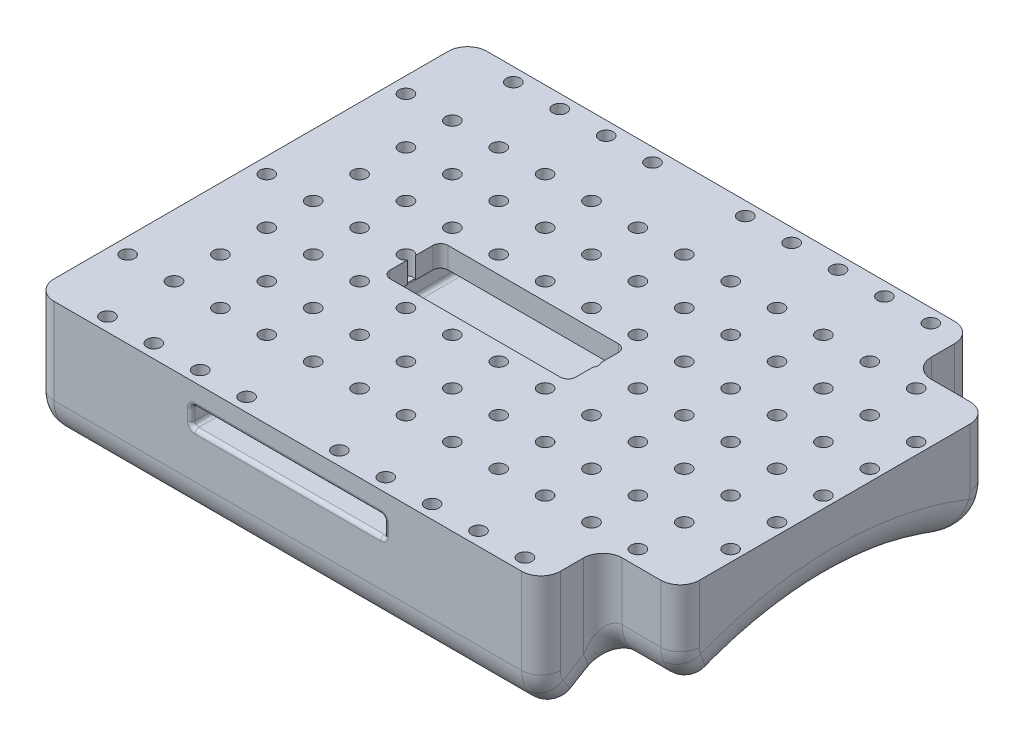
SolidWorks part; units mm, degrees
ref_plane "Front Plane" through (0, 0, 0) normal (0, 0, 1) x (1, 0, 0)
ref_plane "Top Plane" through (0, 0, 0) normal (0, 1, 0) x (1, 0, 0)
ref_plane "Right Plane" through (0, 0, 0) normal (1, 0, 0) x (0, 0, -1)
sketch "Sketch1" plane through (0, 0, 0) normal (0, 1, 0) x (1, 0, 0)
  line L1 (-100, 56) -> (100, 56)
  line L2 (-100, 56) -> (-100, -56)
  line L3 (-100, -56) -> (100, -56)
  line L4 (100, 56) -> (100, -56)
  line L5 (-100, 56) -> (100, -56) construction
  line L6 (-100, -56) -> (100, 56) construction
  point P0 (0, 0)
  dimension "D1" = 200
  dimension "D2" = 112
extrude "Boss-Extrude1" add sketch "Sketch1" along normal blind 6
sketch "Sketch3" plane through (0, 0, 0) normal (0, 1, 0) x (1, 0, 0)
  line L0 (-100, 0) -> (-110, 0)
  line L1 (-100, 56) -> (-100, -56) construction
  line L2 (-110, 25) -> (-110, -25)
  line L3 (-110, 25) -> (-100, 56)
  line L4 (-110, -25) -> (-100, -56)
  line L5 (-100, -56) -> (-100, 56)
  point P8 (-110, 0)
  dimension "D1" = 50
extrude "Boss-Extrude2" add sketch "Sketch3" along normal blind 6 contours L0 L5 L3 L2 | L4 L5 L0 L2
fillet "Fillet1" radius 10 4 edges at (-100, 3, 56) (-110, 3, 25) (-110, 3, -25) (-100, 3, -56)
sketch "Sketch5" plane through (0, 0, 0) normal (0, 1, 0) x (1, 0, 0)
  line L1 (100, 56) -> (157.9995, 56)
  line L2 (100, 56) -> (100, -56)
  line L3 (100, -56) -> (157.9995, -56)
  line L4 (157.9995, 56) -> (157.9995, -56)
  dimension "D1" = 112
extrude "Boss-Extrude3" add sketch "Sketch5" along normal blind 6
sketch "Sketch8" plane through (0, 6, 0) normal (0, 1, 0) x (1, 0, 0)
  line L0 (106.9378, 56) -> (106.9378, -56)
  line L1 (157.9995, 56) -> (-92.7184, 56) construction
  line L2 (-92.7184, -56) -> (157.9995, -56) construction
  line L3 (106.9378, 0) -> (156.9378, 0)
  line L4 (106.9378, -56) -> (131.9378, -56)
  line L5 (131.9378, -56) -> (156.9378, -50)
  line L6 (131.9378, 56) -> (156.9378, 50)
  line L7 (106.9378, 56) -> (131.9378, 56)
  circle A0 centre (156.9378, 0) radius 50
  dimension "D1" = 25
extrude "Boss-Extrude4" add sketch "Sketch8" against normal blind 6 contours A0 M16
fillet "Fillet2" radius 20 2 edges at (157.9995, 3, 56) (157.9995, 3, -56)
fillet "Fillet3" radius 20 2 edges at (157.9995, 3, 49.9887) (157.9995, 3, -49.9887)
sketch "Sketch10" plane through (0, 6, 0) normal (0, 1, 0) x (1, 0, 0)
  line L0 (110.9378, 0) -> (202.9378, 0)
  line L1 (114.4408, 17.6069) -> (114.4379, -17.6)
  line L2 (-92.7184, -56) -> (143.7056, -56) construction
  circle A0 centre (156.9378, 0) radius 46
  circle A3 centre (114.4408, 17.6069) radius 1.65
  circle A4 centre (139.3378, 42.4999) radius 1.65
  circle A5 centre (174.5447, 42.497) radius 1.65
  circle A6 centre (199.4377, 17.6) radius 1.65
  circle A7 centre (199.4349, -17.6069) radius 1.65
  circle A8 centre (174.5378, -42.4999) radius 1.65
  circle A9 centre (139.331, -42.497) radius 1.65
  circle A10 centre (114.4379, -17.6) radius 1.65
  dimension "D1" = 8
  dimension "D5" = 3.3
  dimension "D3" = 92
  dimension "D4" = 17.6
  dimension "D2" = 35.2069
  dimension "D6" = 56
extrude "Cut-Extrude4" cut sketch "Sketch10" against normal blind 3 contours A10 | A3 | A4 | A5 | A9 | A8 | A7 | A6
sketch "Sketch11" plane through (0, 6, 0) normal (0, 1, 0) x (1, 0, 0)
  line L2 (139.331, -42.497) -> (139.289, -42.7462)
  line L4 (174.5378, -42.4999) -> (199.4349, -17.6069)
  line L8 (139.3378, 42.4999) -> (114.4408, 17.6069)
  line L9 (156.9378, 50) -> (106.9378, 50)
  line L10 (106.9378, 50) -> (106.9378, 0)
  line L11 (106.9378, 0) -> (106.9378, -50)
  line L12 (106.9378, -50) -> (156.9378, -50)
  line L13 (106.9378, 50) -> (113.4008, 43.537)
  line L14 (106.9378, 0) -> (113.4008, 0)
  circle A1 centre (113.4008, 43.537) radius 1.65
  circle A2 centre (113.4008, -43.537) radius 1.65
extrude "Cut-Extrude5" cut sketch "Sketch11" against normal blind 7.5
sketch "Sketch13" plane through (0, 6, 0) normal (0, 1, 0) x (1, 0, 0)
  line L0 (-106.5, 0) -> (-84.1762, 0)
  line L10 (-92.7184, -52.5) -> (143.7056, -52.5)
  line L11 (143.7056, 52.5) -> (-92.7184, 52.5)
  line L12 (-98.9045, 47.9955) -> (-106.1861, 25.4225)
  line L13 (-106.5, 23.427) -> (-106.5, -23.427)
  line L14 (-106.1861, -25.4225) -> (-98.9045, -47.9955)
  line L15 (-92.7184, -52.5) -> (143.7056, -52.5)
  line L16 (143.7056, 52.5) -> (-92.7184, 52.5)
  line L17 (-98.9045, 47.9955) -> (-106.1861, 25.4225)
  line L18 (-106.5, 23.427) -> (-106.5, -23.427)
  line L19 (-106.1861, -25.4225) -> (-98.9045, -47.9955)
  circle A0 centre (-92.7184, -52.5) radius 1.8
  circle A1 centre (-80.7184, -52.5) radius 1.8
  circle A2 centre (-80.7184, 52.5) radius 1.8
  circle A3 centre (-68.7184, -52.5) radius 1.8
  circle A4 centre (-68.7184, 52.5) radius 1.8
  circle A5 centre (-56.7184, -52.5) radius 1.8
  circle A6 centre (-56.7184, 52.5) radius 1.8
  circle A7 centre (-44.7184, -52.5) radius 1.8
  circle A8 centre (-44.7184, 52.5) radius 1.8
  circle A9 centre (-92.7184, 52.5) radius 1.8
  circle A10 centre (-32.7184, -52.5) radius 1.8
  circle A11 centre (-32.7184, 52.5) radius 1.8
  circle A12 centre (-20.7184, -52.5) radius 1.8
  circle A13 centre (-20.7184, 52.5) radius 1.8
  circle A14 centre (-8.7184, -52.5) radius 1.8
  circle A15 centre (-8.7184, 52.5) radius 1.8
  circle A16 centre (3.2816, -52.5) radius 1.8
  circle A17 centre (3.2816, 52.5) radius 1.8
  arc A18 (143.7056, -52.5) -> (152.7479, -49.8017) centre (143.7056, -36) ccw
  arc A19 (162.7095, -46.1404) -> (152.7479, -49.8017) centre (165.6263, -69.4587) ccw
  arc A20 (162.7095, -46.1404) -> (162.7095, 46.1404) centre (156.9378, 0) ccw
  arc A21 (152.7479, 49.8017) -> (162.7095, 46.1404) centre (165.6263, 69.4587) ccw
  arc A22 (152.7479, 49.8017) -> (143.7056, 52.5) centre (143.7056, 36) ccw
  arc A23 (-92.7184, 52.5) -> (-98.9045, 47.9955) centre (-92.7184, 46) ccw
  arc A24 (-106.1861, 25.4225) -> (-106.5, 23.427) centre (-100, 23.427) ccw
  arc A25 (-106.5, -23.427) -> (-106.1861, -25.4225) centre (-100, -23.427) ccw
  arc A26 (-98.9045, -47.9955) -> (-92.7184, -52.5) centre (-92.7184, -46) ccw
  arc A27 (143.7056, -52.5) -> (152.7479, -49.8017) centre (143.7056, -36) ccw
  arc A28 (162.7095, -46.1404) -> (152.7479, -49.8017) centre (165.6263, -69.4587) ccw
  arc A29 (162.7095, -46.1404) -> (162.7095, 46.1404) centre (156.9378, 0) ccw
  arc A30 (152.7479, 49.8017) -> (162.7095, 46.1404) centre (165.6263, 69.4587) ccw
  arc A31 (152.7479, 49.8017) -> (143.7056, 52.5) centre (143.7056, 36) ccw
  arc A32 (-92.7184, 52.5) -> (-98.9045, 47.9955) centre (-92.7184, 46) ccw
  arc A33 (-106.1861, 25.4225) -> (-106.5, 23.427) centre (-100, 23.427) ccw
  arc A34 (-106.5, -23.427) -> (-106.1861, -25.4225) centre (-100, -23.427) ccw
  arc A35 (-98.9045, -47.9955) -> (-92.7184, -52.5) centre (-92.7184, -46) ccw
  circle A36 centre (15.2816, -52.5) radius 1.8
  circle A37 centre (15.2816, 52.5) radius 1.8
  circle A38 centre (27.2816, -52.5) radius 1.8
  circle A39 centre (27.2816, 52.5) radius 1.8
  circle A40 centre (39.2816, -52.5) radius 1.8
  circle A41 centre (39.2816, 52.5) radius 1.8
  circle A42 centre (51.2816, -52.5) radius 1.8
  circle A43 centre (51.2816, 52.5) radius 1.8
  circle A44 centre (63.2816, -52.5) radius 1.8
  circle A45 centre (63.2816, 52.5) radius 1.8
  circle A46 centre (75.2816, -52.5) radius 1.8
  circle A47 centre (75.2816, 52.5) radius 1.8
  circle A48 centre (87.2816, -52.5) radius 1.8
  circle A49 centre (87.2816, 52.5) radius 1.8
  circle A50 centre (99.2816, -52.5) radius 1.8
  circle A51 centre (99.2816, 52.5) radius 1.8
  circle A52 centre (111.2816, -52.5) radius 1.8
  circle A53 centre (111.2816, 52.5) radius 1.8
  circle A54 centre (123.2816, -52.5) radius 1.8
  circle A55 centre (123.2816, 52.5) radius 1.8
  circle A56 centre (135.2816, -52.5) radius 1.8
  circle A57 centre (135.2816, 52.5) radius 1.8
  dimension "D2" = 20
  dimension "D1" = 3.5
extrude "Cut-Extrude7" cut sketch "Sketch13" against normal blind 10 contours A9 | A2 | A4 | A6 | A11 | A13 | A15 | A17 | A39 | A41 | A43 | A45 | A47 | A49 | A51 | A53 | A55 | A57 | A56 | A54 | A52 | A50 | A48 | A46 | A40 | A38 | A16 | A14 | A12 | A10 | A5 | A0 | A1 | A3 | A44 | A42
sketch "Sketch14" plane through (0, 6, 0) normal (0, 1, 0) x (1, 0, 0)
  line L0 (-110, 0) -> (-70, 0)
  line L1 (-110, 23.427) -> (-110, -23.427) construction
  line L2 (-70, 0) -> (30, 0)
  circle A0 centre (-20, 0) radius 1.8
  circle A1 centre (-8, 0) radius 1.8
  circle A2 centre (4, 0) radius 1.8
  circle A3 centre (16, 0) radius 1.8
  circle A4 centre (28, 0) radius 1.8
  circle A5 centre (-32, 0) radius 1.8
  circle A6 centre (-44, 0) radius 1.8
  circle A7 centre (-56, 0) radius 1.8
  circle A8 centre (-68, 0) radius 1.8
  circle A9 centre (-68, 12) radius 1.8
  circle A17 centre (28, 12) radius 1.8
  circle A18 centre (-68, 24) radius 1.8
  circle A26 centre (28, 24) radius 1.8
  circle A27 centre (-68, 36) radius 1.8
  circle A28 centre (-56, 36) radius 1.8
  circle A29 centre (-44, 36) radius 1.8
  circle A30 centre (-32, 36) radius 1.8
  circle A31 centre (-20, 36) radius 1.8
  circle A32 centre (-8, 36) radius 1.8
  circle A33 centre (4, 36) radius 1.8
  circle A34 centre (16, 36) radius 1.8
  circle A35 centre (28, 36) radius 1.8
  circle A36 centre (-68, -12) radius 1.8
  circle A44 centre (28, -12) radius 1.8
  circle A45 centre (-68, -24) radius 1.8
  circle A53 centre (28, -24) radius 1.8
  circle A54 centre (-68, -36) radius 1.8
  circle A55 centre (-56, -36) radius 1.8
  circle A56 centre (-44, -36) radius 1.8
  circle A57 centre (-32, -36) radius 1.8
  circle A58 centre (-20, -36) radius 1.8
  circle A59 centre (-8, -36) radius 1.8
  circle A60 centre (4, -36) radius 1.8
  circle A61 centre (16, -36) radius 1.8
  circle A62 centre (28, -36) radius 1.8
  circle A63 centre (40, 36) radius 1.8
  circle A64 centre (40, 24) radius 1.8
  circle A65 centre (40, 12) radius 1.8
  circle A66 centre (40, 0) radius 1.8
  circle A69 centre (40, -36) radius 1.8
  circle A70 centre (52, 36) radius 1.8
  circle A73 centre (52, 0) radius 1.8
  circle A76 centre (52, -36) radius 1.8
  circle A77 centre (64, 36) radius 1.8
  circle A80 centre (64, 0) radius 1.8
  circle A83 centre (64, -36) radius 1.8
  circle A84 centre (76, 36) radius 1.8
  circle A87 centre (76, 0) radius 1.8
  circle A90 centre (76, -36) radius 1.8
  circle A91 centre (88, 36) radius 1.8
  circle A94 centre (88, 0) radius 1.8
  circle A97 centre (88, -36) radius 1.8
  circle A98 centre (100, 36) radius 1.8
  circle A101 centre (100, 0) radius 1.8
  circle A104 centre (100, -36) radius 1.8
  circle A105 centre (112, 36) radius 1.8
  circle A106 centre (112, 24) radius 1.8
  circle A107 centre (112, 12) radius 1.8
  circle A108 centre (112, 0) radius 1.8
  circle A109 centre (112, -12) radius 1.8
  circle A110 centre (112, -24) radius 1.8
  circle A111 centre (112, -36) radius 1.8
  circle A112 centre (-56, -12) radius 1.8
  circle A113 centre (-44, -12) radius 1.8
  circle A114 centre (-32, -12) radius 1.8
  circle A115 centre (-20, -12) radius 1.8
  circle A116 centre (-8, -12) radius 1.8
  circle A117 centre (4, -12) radius 1.8
  circle A118 centre (16, -12) radius 1.8
  circle A119 centre (-56, -24) radius 1.8
  circle A120 centre (-44, -24) radius 1.8
  circle A121 centre (-32, -24) radius 1.8
  circle A122 centre (-20, -24) radius 1.8
  circle A123 centre (-8, -24) radius 1.8
  circle A124 centre (4, -24) radius 1.8
  circle A125 centre (16, -24) radius 1.8
  circle A126 centre (-56, 12) radius 1.8
  circle A127 centre (-44, 12) radius 1.8
  circle A128 centre (-32, 12) radius 1.8
  circle A129 centre (-20, 12) radius 1.8
  circle A130 centre (-8, 12) radius 1.8
  circle A131 centre (4, 12) radius 1.8
  circle A132 centre (16, 12) radius 1.8
  circle A133 centre (-56, 24) radius 1.8
  circle A134 centre (-44, 24) radius 1.8
  circle A135 centre (-32, 24) radius 1.8
  circle A136 centre (-20, 24) radius 1.8
  circle A137 centre (-8, 24) radius 1.8
  circle A138 centre (4, 24) radius 1.8
  circle A139 centre (16, 24) radius 1.8
  circle A140 centre (52, 24) radius 1.8
  circle A141 centre (52, 12) radius 1.8
  circle A142 centre (64, 24) radius 1.8
  circle A143 centre (64, 12) radius 1.8
  circle A144 centre (76, 24) radius 1.8
  circle A145 centre (76, 12) radius 1.8
  circle A146 centre (88, 24) radius 1.8
  circle A147 centre (88, 12) radius 1.8
  circle A148 centre (100, 24) radius 1.8
  circle A149 centre (100, 12) radius 1.8
  circle A150 centre (40, -12) radius 1.8
  circle A151 centre (40, -24) radius 1.8
  circle A152 centre (52, -12) radius 1.8
  circle A153 centre (52, -24) radius 1.8
  circle A154 centre (64, -12) radius 1.8
  circle A155 centre (64, -24) radius 1.8
  circle A156 centre (76, -12) radius 1.8
  circle A157 centre (76, -24) radius 1.8
  circle A158 centre (88, -12) radius 1.8
  circle A159 centre (88, -24) radius 1.8
  circle A160 centre (100, -12) radius 1.8
  circle A161 centre (100, -24) radius 1.8
  circle A162 centre (40, -12) radius 1.8
  circle A163 centre (40, -24) radius 1.8
  dimension "D1" = 5
  dimension "D2" = 5
  dimension "D3" = 4
  dimension "D4" = 4
  dimension "D5" = 8
  dimension "D6" = 3
extrude "Cut-Extrude12" cut sketch "Sketch14" against normal blind 10 contours L2 A0 | L2 A0 | A73 | A80 | A63 | A70 | A27 | A18 | A28 | A29 | A30 | A31 | A32 | A33 | A34 | A9 | A8 | A7 | A36 | A45 | A54 | A55 | A56 | A57 | A58 | A59 | A60 | A61 | A62 | A53 | A44 | A4 | A3 | A2 | A1 | A5 | A6 | A17 | A26 | A64 | A65 | A66 | A162 | A35 | A77 | A83 | A76 | A69 | A163 | A87 | A94 | A101 | A108 | A109 | A110 | A107
sketch "Sketch15" plane through (0, 6, 0) normal (0, 1, 0) x (1, 0, 0)
  line L0 (206.9378, 0) -> (-48.0622, 0)
  line L2 (-48.0622, 65.6555) -> (-123.834, 65.6555)
  line L3 (-48.0622, 65.6555) -> (-48.0622, -63.0721)
  line L4 (-48.0622, -63.0721) -> (-123.834, -63.0721)
  line L5 (-123.834, 65.6555) -> (-123.834, -63.0721)
  arc A0 (163.1439, -49.6134) -> (163.1439, 49.6134) centre (156.9378, 0) ccw construction
  dimension "D1" = 255
extrude "Cut-Extrude13" cut sketch "Sketch15" against normal blind 10 contours L2 L5 L4 L3
sketch "Sketch16" plane through (0, 6, 0) normal (0, 1, 0) x (1, 0, 0)
  line L0 (-48.0622, 0) -> (102.9378, 0)
  line L1 (-48.0622, 56) -> (-48.0622, -56) construction
  line L3 (102.9378, 64.6969) -> (216.5279, 64.6969)
  line L4 (102.9378, 64.6969) -> (102.9378, -67.3494)
  line L5 (102.9378, -67.3494) -> (216.5279, -67.3494)
  line L6 (216.5279, 64.6969) -> (216.5279, -67.3494)
extrude "Cut-Extrude14" cut sketch "Sketch16" against normal blind 10 contours L6 L3 L4 L5
sketch "Sketch17" plane through (0, 6, 0) normal (0, 1, 0) x (1, 0, 0)
  line L0 (102.9378, 0) -> (82.9378, 0)
  line L1 (102.9378, 56) -> (102.9378, -56) construction
  line L3 (82.9378, 40) -> (102.9378, 40)
  line L4 (82.9378, 40) -> (82.9378, -40)
  line L5 (82.9378, -40) -> (102.9378, -40)
  line L6 (102.9378, 40) -> (102.9378, -40)
  line L7 (82.9378, 40) -> (102.9378, -40) construction
  line L8 (82.9378, -40) -> (102.9378, 40) construction
  line L9 (82.9378, 40) -> (116.8738, 40)
  line L10 (82.9378, 40) -> (82.9378, 66.2952)
  line L11 (82.9378, 66.2952) -> (116.8738, 66.2952)
  line L12 (116.8738, 40) -> (116.8738, 66.2952)
  line L13 (82.9378, -40) -> (120.0009, -40)
  line L14 (82.9378, -40) -> (82.9378, -61.9172)
  line L15 (82.9378, -61.9172) -> (120.0009, -61.9172)
  line L16 (120.0009, -40) -> (120.0009, -61.9172)
  point P5 (92.9378, 0)
  dimension "D1" = 20
  dimension "D2" = 80
extrude "Cut-Extrude15" cut sketch "Sketch17" against normal blind 10 contours L9 L12 L11 L10 L3 | L16 L13 L5 L14 L15
fillet "Fillet4" radius 5 4 edges at (82.9378, 3, 40) (82.9378, 3, -40) (102.9378, 3, 40) (102.9378, 3, -40)
fillet "Fillet5" radius 5 4 edges at (82.9378, 3, -56) (-48.0622, 3, -56) (-48.0622, 3, 56) (82.9378, 3, 56)
sketch "Sketch18" plane through (0, 6, 0) normal (0, 1, 0) x (1, 0, 0)
  circle A0 centre (-32, 36) radius 1.8
  circle A1 centre (-20, 36) radius 1.8
  circle A2 centre (-8, 36) radius 1.8
  circle A3 centre (4, 36) radius 1.8
  circle A4 centre (16, 36) radius 1.8
  circle A5 centre (28, 36) radius 1.8
  circle A6 centre (40, 36) radius 1.8
  circle A7 centre (52, 36) radius 1.8
  circle A8 centre (64, 36) radius 1.8
  circle A9 centre (76, 36) radius 1.8
  circle A10 centre (88, 36) radius 1.8
  circle A12 centre (-20, 24) radius 1.8
  circle A13 centre (-8, 24) radius 1.8
  circle A14 centre (4, 24) radius 1.8
  circle A15 centre (16, 24) radius 1.8
  circle A16 centre (28, 24) radius 1.8
  circle A17 centre (40, 24) radius 1.8
  circle A18 centre (52, 24) radius 1.8
  circle A19 centre (64, 24) radius 1.8
  circle A20 centre (76, 24) radius 1.8
  circle A21 centre (88, 24) radius 1.8
  circle A22 centre (100, 24) radius 1.8
  circle A23 centre (-20, 12) radius 1.8
  circle A24 centre (-8, 12) radius 1.8
  circle A25 centre (4, 12) radius 1.8
  circle A26 centre (16, 12) radius 1.8
  circle A27 centre (28, 12) radius 1.8
  circle A28 centre (40, 12) radius 1.8
  circle A29 centre (52, 12) radius 1.8
  circle A30 centre (64, 12) radius 1.8
  circle A31 centre (76, 12) radius 1.8
  circle A32 centre (88, 12) radius 1.8
  circle A33 centre (100, 12) radius 1.8
  circle A34 centre (-20, 0) radius 1.8
  circle A35 centre (-8, 0) radius 1.8
  circle A36 centre (4, 0) radius 1.8
  circle A37 centre (16, 0) radius 1.8
  circle A38 centre (28, 0) radius 1.8
  circle A39 centre (40, 0) radius 1.8
  circle A40 centre (52, 0) radius 1.8
  circle A41 centre (64, 0) radius 1.8
  circle A42 centre (76, 0) radius 1.8
  circle A43 centre (88, 0) radius 1.8
  circle A44 centre (100, 0) radius 1.8
  circle A45 centre (-20, -12) radius 1.8
  circle A46 centre (-8, -12) radius 1.8
  circle A47 centre (4, -12) radius 1.8
  circle A48 centre (16, -12) radius 1.8
  circle A49 centre (28, -12) radius 1.8
  circle A50 centre (40, -12) radius 1.8
  circle A51 centre (52, -12) radius 1.8
  circle A52 centre (64, -12) radius 1.8
  circle A53 centre (76, -12) radius 1.8
  circle A54 centre (88, -12) radius 1.8
  circle A55 centre (100, -12) radius 1.8
  circle A56 centre (-20, -24) radius 1.8
  circle A57 centre (-8, -24) radius 1.8
  circle A58 centre (4, -24) radius 1.8
  circle A59 centre (16, -24) radius 1.8
  circle A60 centre (28, -24) radius 1.8
  circle A61 centre (40, -24) radius 1.8
  circle A62 centre (52, -24) radius 1.8
  circle A63 centre (64, -24) radius 1.8
  circle A64 centre (76, -24) radius 1.8
  circle A65 centre (88, -24) radius 1.8
  circle A66 centre (100, -24) radius 1.8
  circle A67 centre (-20, -36) radius 1.8
  circle A68 centre (-8, -36) radius 1.8
  circle A69 centre (4, -36) radius 1.8
  circle A70 centre (16, -36) radius 1.8
  circle A71 centre (28, -36) radius 1.8
  circle A72 centre (40, -36) radius 1.8
  circle A73 centre (52, -36) radius 1.8
  circle A74 centre (64, -36) radius 1.8
  circle A75 centre (76, -36) radius 1.8
  circle A76 centre (88, -36) radius 1.8
  circle A78 centre (-32, 24) radius 1.8
  circle A79 centre (-32, 12) radius 1.8
  circle A80 centre (-32, 0) radius 1.8
  circle A81 centre (-32, -12) radius 1.8
  circle A82 centre (-32, -24) radius 1.8
  circle A83 centre (-32, -36) radius 1.8
  circle A84 centre (100, -36) radius 1.8
  circle A85 centre (100, 36) radius 1.8
  dimension "D1" = 12
  dimension "D2" = 7
extrude "Cut-Extrude16" cut sketch "Sketch18" against normal blind 10
sketch "Sketch19" plane through (0, 0, 0) normal (0, -1, 0) x (1, 0, 0)
  line L16 (-43.0622, -56) -> (77.9378, -56)
  line L17 (82.9378, -51) -> (82.9378, -45)
  line L18 (87.9378, -40) -> (97.9378, -40)
  line L19 (102.9378, -35) -> (102.9378, 35)
  line L20 (97.9378, 40) -> (87.9378, 40)
  line L21 (82.9378, 45) -> (82.9378, 51)
  line L22 (77.9378, 56) -> (-43.0622, 56)
  line L23 (-48.0622, 51) -> (-48.0622, -51)
  line L24 (-43.0622, -56) -> (77.9378, -56)
  line L25 (82.9378, -51) -> (82.9378, -45)
  line L26 (87.9378, -40) -> (97.9378, -40)
  line L27 (102.9378, -35) -> (102.9378, 35)
  line L28 (97.9378, 40) -> (87.9378, 40)
  line L29 (82.9378, 45) -> (82.9378, 51)
  line L30 (77.9378, 56) -> (-43.0622, 56)
  line L31 (-48.0622, 51) -> (-48.0622, -51)
  arc A16 (77.9378, -56) -> (82.9378, -51) centre (77.9378, -51) ccw
  arc A17 (87.9378, -40) -> (82.9378, -45) centre (87.9378, -45) ccw
  arc A18 (97.9378, -40) -> (102.9378, -35) centre (97.9378, -35) ccw
  arc A19 (102.9378, 35) -> (97.9378, 40) centre (97.9378, 35) ccw
  arc A20 (82.9378, 45) -> (87.9378, 40) centre (87.9378, 45) ccw
  arc A21 (82.9378, 51) -> (77.9378, 56) centre (77.9378, 51) ccw
  arc A22 (-43.0622, 56) -> (-48.0622, 51) centre (-43.0622, 51) ccw
  arc A23 (-48.0622, -51) -> (-43.0622, -56) centre (-43.0622, -51) ccw
  arc A24 (77.9378, -56) -> (82.9378, -51) centre (77.9378, -51) ccw
  arc A25 (87.9378, -40) -> (82.9378, -45) centre (87.9378, -45) ccw
  arc A26 (97.9378, -40) -> (102.9378, -35) centre (97.9378, -35) ccw
  arc A27 (102.9378, 35) -> (97.9378, 40) centre (97.9378, 35) ccw
  arc A28 (82.9378, 45) -> (87.9378, 40) centre (87.9378, 45) ccw
  arc A29 (82.9378, 51) -> (77.9378, 56) centre (77.9378, 51) ccw
  arc A30 (-43.0622, 56) -> (-48.0622, 51) centre (-43.0622, 51) ccw
  arc A31 (-48.0622, -51) -> (-43.0622, -56) centre (-43.0622, -51) ccw
  dimension "D1" = 0
extrude "Boss-Extrude5" add sketch "Sketch19" along normal blind 40
sketch "Sketch20" plane through (102.9378, 0, 0) normal (1, 0, 0) x (0, 0, -1)
  line L0 (0, 6) -> (0, -14)
  line L1 (35, 6) -> (-35, 6) construction
  line L2 (0, -14) -> (0, -96.5)
  circle A0 centre (0, -96.5) radius 82.5
  dimension "D1" = 20
extrude "Cut-Extrude17" cut sketch "Sketch20" against normal blind 342
fillet "Fillet6" radius 10 16 edges at (-45.5923, -35.2891, 55.3126) (-48.0622, -14, 0) (-46.3637, -34.7899, -54.755) (17.4378, -35.9174, -56) (80.468, -35.2891, -55.3126) (82.9378, -29.4356, -48.0481) (85.1162, -24.8361, -40.8722) (92.9378, -24.3457, -40) (100.7793, -23.8616, -39.1141) (102.9378, -14, 0) (101.5994, -23.4841, 38.4049) (92.9378, -24.3457, 40) (84.6375, -25.0494, 41.244) (82.9378, -29.4356, 48.0481) (81.2394, -34.7899, 54.755) (17.4378, -35.9174, 56)
sketch "Sketch21" plane through (0, 0, 56) normal (0, 0, 1) x (1, 0, 0)
  line L0 (17.4378, 6) -> (17.4378, -2)
  line L1 (-43.0622, 6) -> (77.9378, 6) construction
  line L2 (42.4378, -2) -> (-7.5622, -2)
  line L4 (42.4378, -4.5) -> (-7.5622, -4.5)
  line L5 (42.4378, -4.5) -> (42.4378, 0.5)
  line L6 (42.4378, 0.5) -> (-7.5622, 0.5)
  line L7 (-7.5622, -4.5) -> (-7.5622, 0.5)
  line L8 (42.4378, -4.5) -> (-7.5622, 0.5) construction
  line L9 (42.4378, 0.5) -> (-7.5622, -4.5) construction
  point P9 (17.4378, -2)
  dimension "D1" = 8
  dimension "D2" = 50
  dimension "D3" = 5
extrude "Cut-Extrude18" cut sketch "Sketch21" against normal blind 342 contours L5 L6 L0 L2 | L7 L4 L5 L2 | L7 L2 L0 L6
fillet "Fillet7" radius 1 4 edges at (-7.5622, 0.5, 44.4332) (-7.5622, -4.5, 0) (42.4378, 0.5, 0) (42.4378, -4.5, 0)
fillet "Fillet8" radius 1 16 edges at (42.1449, -4.2071, -56) (17.4378, -4.5, -56) (-7.2693, -4.2071, -56) (-7.5622, -2, -56) (-7.2693, 0.2071, -56) (17.4378, 0.5, -56) (42.1449, 0.2071, -56) (42.1449, -4.2071, 56) (42.4378, -2, 56) (42.1449, 0.2071, 56) (17.4378, 0.5, 56) (-7.2693, 0.2071, 56) (-7.5622, -2, 56) (-7.2693, -4.2071, 56) (42.4378, -2, -56) (17.4378, -4.5, 56)
sketch "Sketch22" plane through (0, 6, 0) normal (0, 1, 0) x (1, 0, 0)
  line L0 (-6.5622, 0) -> (41.4378, 0)
  line L1 (-6.5622, 55) -> (-6.5622, -55) construction
  line L2 (41.4378, -55) -> (41.4378, 55) construction
  line L4 (-6.5622, 7.5) -> (41.4378, 7.5)
  line L5 (-6.5622, 7.5) -> (-6.5622, -7.5)
  line L6 (-6.5622, -7.5) -> (41.4378, -7.5)
  line L7 (41.4378, 7.5) -> (41.4378, -7.5)
  line L8 (-6.5622, 7.5) -> (41.4378, -7.5) construction
  line L9 (-6.5622, -7.5) -> (41.4378, 7.5) construction
  point P6 (17.4378, 0)
  dimension "D1" = 15
extrude "Cut-Extrude19" cut sketch "Sketch22" against normal blind 8 contours L7 L4 L5 L0 | L7 L0 L5 L6
fillet "Fillet9" radius 2 4 edges at (41.4378, 3.25, 7.5) (41.4378, 3.25, -7.5) (-6.5622, 3.25, 7.5) (-6.5622, 3.25, -7.5)
